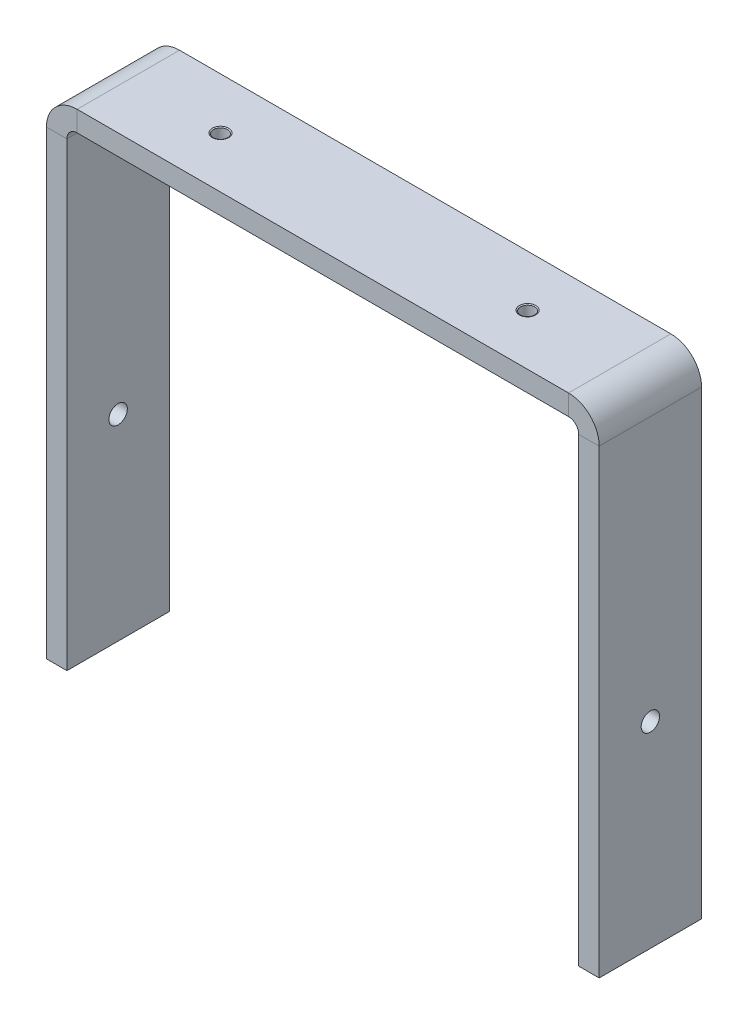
SolidWorks part; units mm, degrees
ref_plane "Plan1" through (0, 0, 0) normal (0, 0, 1) x (1, 0, 0)
ref_plane "Plan2" through (0, 0, 0) normal (0, 1, 0) x (1, 0, 0)
ref_plane "Plan3" through (0, 0, 0) normal (1, 0, 0) x (0, 0, -1)
sketch "Esquisse1" plane through (0, 0, 0) normal (0, 0, 1) x (1, 0, 0)
  line L0 (-135, 0) -> (-135, 240)
  line L1 (-135, 240) -> (135, 240)
  line L2 (135, 240) -> (135, 0)
  line L3 (0, 17.4303) -> (0, -17.4303) construction
  dimension "D1" = 270
  dimension "D2" = 240
  dimension "D3" = 240
extrude "Base-Extru.-Mince" add sketch "Esquisse1" along normal mid plane 50 thin
sketch "Esquisse2"
  line L0 (0, 8.1438) -> (0, -8.1438) construction
  circle A0 centre (75, 0) radius 3.45
  circle A1 centre (-75, 0) radius 3.45
  dimension "D1" = 150
  dimension "D2" = 6.9
bend "Pli dans angle1" parameters "D1"=0
flatten bends "Dépliage 1" parameters "D1"=0
sketch "Esquisse-Angle1" plane through (-125, 0, 0) normal (1, 0, 0) x (0, 0, -1)
  line L0 (25, 232.854) -> (-25, 232.854) construction
  line L1 (25, 488.5619) -> (-25, 488.5619) construction
bend "Pli dans angle2" bend angle 90 parameters "D1"=0, "D5"=1
sheet metal parameters "Tôlerie 1" parameters "D1"=5, "D4"=90, "D5"=2
extrude "Enlèv. mat.-Extru.1" cut sketch "Esquisse2" against normal through all
chamfer "Chanfrein1" distance 0.55 angle 30
sketch "Esquisse3" plane through (0, 0, 0) normal (1, 0, 0) x (0, 0, -1)
  circle A0 centre (0, 96) radius 4.5
  dimension "D1" = 9
  dimension "D2" = 96
extrude "Enlèv. mat.-Extru.2" cut sketch "Esquisse3" against normal through all and the other way through all
process bends "Pliage 1" parameters "D1"=0
sketch "Esquisse-Plate1" plane through (-125, 0, 0) normal (1, 0, 0) x (0, 0, -1)
